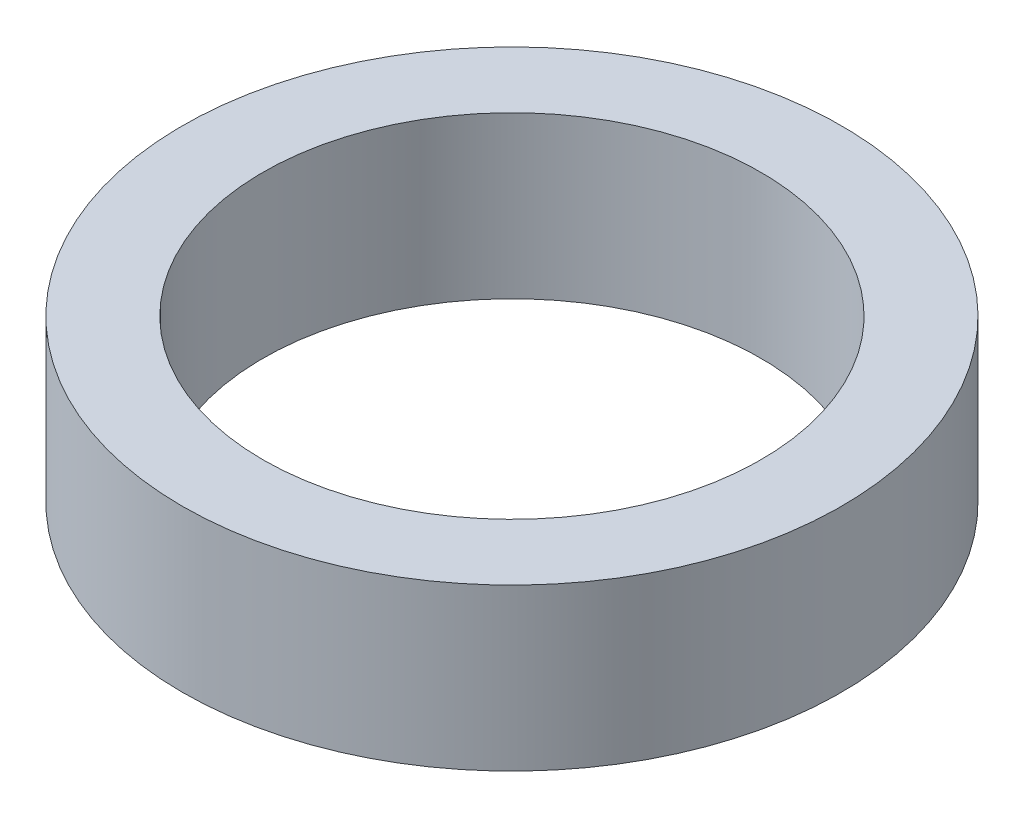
SolidWorks part; units mm, degrees
ref_plane "前视基准面" through (0, 0, 0) normal (0, 0, 1) x (1, 0, 0)
ref_plane "上视基准面" through (0, 0, 0) normal (0, 1, 0) x (1, 0, 0)
ref_plane "右视基准面" through (0, 0, 0) normal (1, 0, 0) x (0, 0, -1)
sketch "草图1" plane through (0, 0, 0) normal (0, 1, 0) x (1, 0, 0)
  circle A0 centre (0, 0) radius 17
  circle A1 centre (0, 0) radius 22.5
  dimension "D1" = 45
  dimension "D2" = 34
extrude "凸台-拉伸1" add sketch "草图1" along normal blind 11
